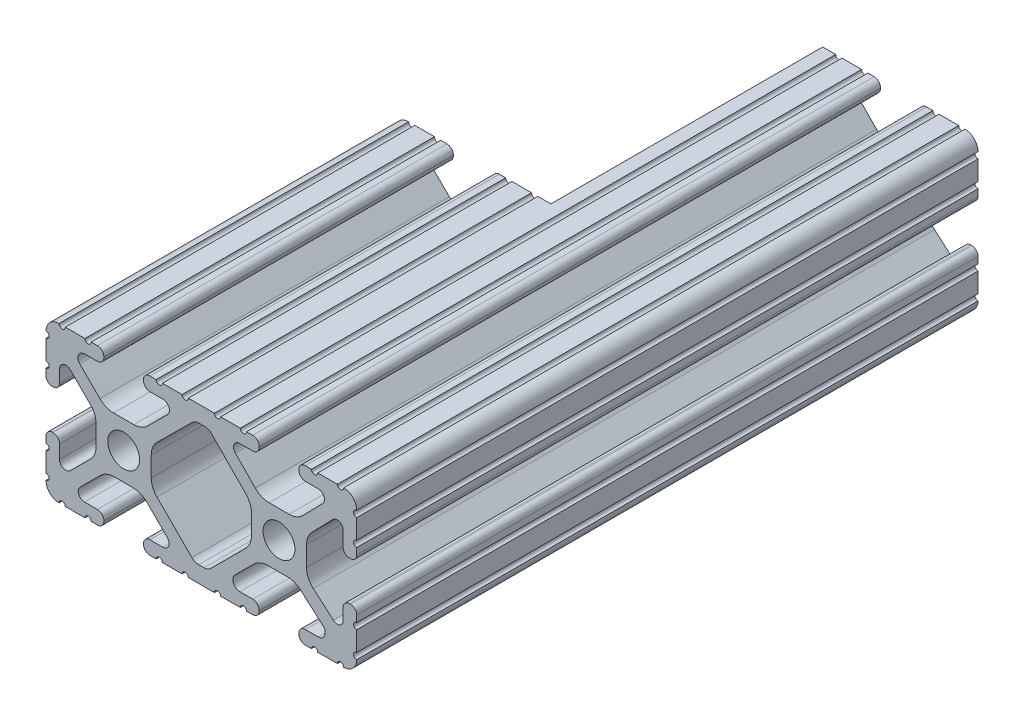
SolidWorks part; units mm, degrees
ref_plane "Front" through (0, 0, 0) normal (0, 0, 1) x (1, 0, 0)
ref_plane "Top" through (0, 0, 0) normal (0, 1, 0) x (1, 0, 0)
ref_plane "Right" through (0, 0, 0) normal (1, 0, 0) x (0, 0, -1)
sketch "Sketch1" plane through (0, 0, 0) normal (0, 0, 1) x (1, 0, 0)
  line L0 (-20.1324, -9.4742) -> (-5.2676, -9.4742) construction
  line L16 (-7.2595, -3.8694) -> (-1.5457, -9.5728)
  line L17 (-8.1915, 1.6223) -> (-8.1915, -1.6223)
  line L18 (-1.504, 9.5765) -> (-7.252, 3.8768)
  line L19 (0.5515, 10.033) -> (-0.3952, 10.033)
  line L20 (7.2829, 3.8459) -> (1.6756, 9.5611)
  line L21 (8.1915, -1.6223) -> (8.1915, 1.6223)
  line L22 (1.5457, -9.5728) -> (7.2595, -3.8694)
  line L23 (-0.4332, -10.033) -> (0.4332, -10.033)
  line L136 (18.0171, 12.7) -> (16.9875, 12.7)
  line L137 (15.9385, 11.651) -> (15.9385, 11.5392)
  line L138 (16.9875, 10.4902) -> (19.1164, 10.4902)
  line L139 (19.8441, 8.7652) -> (16.619, 5.4551)
  line L140 (14.3449, 4.4958) -> (11.0833, 4.4958)
  line L141 (8.817, 5.4472) -> (5.5642, 8.7627)
  line L142 (6.2894, 10.4902) -> (8.4125, 10.4902)
  line L143 (9.4615, 11.5392) -> (9.4615, 11.651)
  line L144 (8.4125, 12.7) -> (7.3829, 12.7)
  line L145 (6.3669, 12.7) -> (3.1496, 12.7)
  line L146 (2.1336, 12.7) -> (-2.1336, 12.7)
  line L147 (-3.1496, 12.7) -> (-6.3669, 12.7)
  line L148 (-7.3829, 12.7) -> (-8.4125, 12.7)
  line L149 (-9.4615, 11.651) -> (-9.4615, 11.5392)
  line L150 (-8.4125, 10.4902) -> (-6.2836, 10.4902)
  line L151 (-5.5326, 8.6661) -> (-8.81, 5.4163)
  line L152 (-11.0455, 4.4958) -> (-14.3545, 4.4958)
  line L153 (-16.59, 5.4163) -> (-19.8674, 8.6661)
  line L154 (-19.1164, 10.4902) -> (-16.9875, 10.4902)
  line L155 (-15.9385, 11.5392) -> (-15.9385, 11.651)
  line L156 (-16.9875, 12.7) -> (-18.0171, 12.7)
  line L157 (-19.0331, 12.7) -> (-22.2504, 12.7)
  line L158 (-25.4, 9.5504) -> (-25.4, 6.3331)
  line L159 (-25.4, 5.3171) -> (-25.4, 4.2375)
  line L160 (-24.401, 3.2385) -> (-24.2392, 3.2385)
  line L161 (-23.1902, 4.2875) -> (-23.1902, 6.3347)
  line L162 (-21.434, 7.0665) -> (-18.148, 3.8082)
  line L163 (-17.2085, 1.5536) -> (-17.2085, -1.6952)
  line L164 (-18.1405, -3.9423) -> (-21.4316, -7.2274)
  line L165 (-23.1902, -6.498) -> (-23.1902, -4.2875)
  line L166 (-24.2392, -3.2385) -> (-24.351, -3.2385)
  line L167 (-25.4, -4.2875) -> (-25.4, -5.3171)
  line L168 (-25.4, -6.3331) -> (-25.4, -9.5504)
  line L169 (-22.2504, -12.7) -> (-19.0331, -12.7)
  line L170 (-18.0171, -12.7) -> (-16.9875, -12.7)
  line L171 (-15.9384, -11.651) -> (-15.9384, -11.5392)
  line L172 (-16.9875, -10.4902) -> (-19.1164, -10.4902)
  line L173 (-19.8341, -8.7551) -> (-16.4966, -5.4237)
  line L174 (-14.2536, -4.4958) -> (-11.1464, -4.4958)
  line L175 (-8.9034, -5.4237) -> (-5.5659, -8.7551)
  line L176 (-6.2836, -10.4902) -> (-8.4125, -10.4902)
  line L177 (-9.4616, -11.5392) -> (-9.4616, -11.651)
  line L178 (-8.4125, -12.7) -> (-7.3829, -12.7)
  line L179 (-6.3669, -12.7) -> (-3.1496, -12.7)
  line L180 (-2.1336, -12.7) -> (2.1336, -12.7)
  line L181 (3.1496, -12.7) -> (6.3669, -12.7)
  line L182 (7.3829, -12.7) -> (8.4125, -12.7)
  line L183 (9.4616, -11.651) -> (9.4616, -11.5392)
  line L184 (8.4125, -10.4902) -> (6.2894, -10.4902)
  line L185 (5.4807, -8.5353) -> (8.5979, -5.4237)
  line L186 (10.8409, -4.4958) -> (14.1026, -4.4958)
  line L187 (16.1879, -5.2766) -> (19.8682, -8.4822)
  line L188 (19.1164, -10.4902) -> (16.9875, -10.4902)
  line L189 (15.9384, -11.5392) -> (15.9384, -11.651)
  line L190 (16.9875, -12.7) -> (18.0171, -12.7)
  line L191 (19.0331, -12.7) -> (22.2504, -12.7)
  line L192 (25.4, -9.5504) -> (25.4, -6.3331)
  line L193 (25.4, -5.3171) -> (25.4, -4.2375)
  line L194 (24.401, -3.2385) -> (24.1892, -3.2385)
  line L195 (23.1902, -4.2375) -> (23.1902, -6.1559)
  line L196 (21.584, -6.8869) -> (18.2982, -4.025)
  line L197 (17.2085, -1.6308) -> (17.2085, 1.6308)
  line L198 (18.1094, 3.8465) -> (21.5263, 7.3534)
  line L199 (23.1902, 6.6769) -> (23.1902, 4.2375)
  line L200 (24.1892, 3.2385) -> (24.401, 3.2385)
  line L201 (25.4, 4.2375) -> (25.4, 5.3171)
  line L202 (25.4, 6.3332) -> (25.4, 9.5504)
  line L203 (22.2504, 12.7) -> (19.0331, 12.7)
  circle A2 centre (-12.7, 0) radius 2.6035
  circle A4 centre (12.7, 0) radius 2.6035
  arc A18 (-1.5457, -9.5728) -> (-0.4332, -10.033) centre (-0.4332, -8.4582) ccw
  arc A19 (-8.1915, -1.6223) -> (-7.2595, -3.8694) centre (-5.0165, -1.6223) ccw
  arc A20 (-7.252, 3.8768) -> (-8.1915, 1.6223) centre (-5.0165, 1.6223) ccw
  arc A21 (-0.3952, 10.033) -> (-1.504, 9.5765) centre (-0.3952, 8.4582) ccw
  arc A22 (1.6756, 9.5611) -> (0.5515, 10.033) centre (0.5515, 8.4582) ccw
  arc A23 (8.1915, 1.6223) -> (7.2829, 3.8459) centre (5.0165, 1.6223) ccw
  arc A24 (7.2595, -3.8694) -> (8.1915, -1.6223) centre (5.0165, -1.6223) ccw
  arc A25 (0.4332, -10.033) -> (1.5457, -9.5728) centre (0.4332, -8.4582) ccw
  arc A152 (18.0171, 12.7) -> (19.0331, 12.7) centre (18.5251, 12.7) ccw
  arc A153 (16.9875, 12.7) -> (15.9385, 11.651) centre (16.9875, 11.651) ccw
  arc A154 (15.9385, 11.5392) -> (16.9875, 10.4902) centre (16.9875, 11.5392) ccw
  arc A155 (19.8441, 8.7652) -> (19.1164, 10.4902) centre (19.1164, 9.4742) ccw
  arc A156 (14.3449, 4.4958) -> (16.619, 5.4551) centre (14.3449, 7.6708) ccw
  arc A157 (8.817, 5.4472) -> (11.0833, 4.4958) centre (11.0833, 7.6708) ccw
  arc A158 (6.2894, 10.4902) -> (5.5642, 8.7627) centre (6.2894, 9.4742) ccw
  arc A159 (8.4125, 10.4902) -> (9.4615, 11.5392) centre (8.4125, 11.5392) ccw
  arc A160 (9.4615, 11.651) -> (8.4125, 12.7) centre (8.4125, 11.651) ccw
  arc A161 (6.3669, 12.7) -> (7.3829, 12.7) centre (6.8749, 12.7) ccw
  arc A162 (2.1336, 12.7) -> (3.1496, 12.7) centre (2.6416, 12.7) ccw
  arc A163 (-3.1496, 12.7) -> (-2.1336, 12.7) centre (-2.6416, 12.7) ccw
  arc A164 (-7.3829, 12.7) -> (-6.3669, 12.7) centre (-6.8749, 12.7) ccw
  arc A165 (-8.4125, 12.7) -> (-9.4615, 11.651) centre (-8.4125, 11.651) ccw
  arc A166 (-9.4615, 11.5392) -> (-8.4125, 10.4902) centre (-8.4125, 11.5392) ccw
  arc A167 (-5.5326, 8.6661) -> (-6.2836, 10.4902) centre (-6.2836, 9.4235) ccw
  arc A168 (-11.0455, 4.4958) -> (-8.81, 5.4163) centre (-11.0455, 7.6708) ccw
  arc A169 (-16.59, 5.4163) -> (-14.3545, 4.4958) centre (-14.3545, 7.6708) ccw
  arc A170 (-19.1164, 10.4902) -> (-19.8674, 8.6661) centre (-19.1164, 9.4235) ccw
  arc A171 (-16.9875, 10.4902) -> (-15.9385, 11.5392) centre (-16.9875, 11.5392) ccw
  arc A172 (-15.9385, 11.651) -> (-16.9875, 12.7) centre (-16.9875, 11.651) ccw
  arc A173 (-19.0331, 12.7) -> (-18.0171, 12.7) centre (-18.5251, 12.7) ccw
  arc A174 (-23.2664, 12.6998) -> (-22.2504, 12.7) centre (-22.7584, 12.7) ccw
  arc A175 (-23.2664, 12.6998) -> (-25.3998, 10.5664) centre (-23.2918, 10.5918) ccw
  arc A176 (-25.4, 9.5504) -> (-25.3998, 10.5664) centre (-25.4, 10.0584) ccw
  arc A177 (-25.4, 5.3171) -> (-25.4, 6.3331) centre (-25.4, 5.8251) ccw
  arc A178 (-25.4, 4.2375) -> (-24.401, 3.2385) centre (-24.401, 4.2375) ccw
  arc A179 (-24.2392, 3.2385) -> (-23.1902, 4.2875) centre (-24.2392, 4.2875) ccw
  arc A180 (-21.434, 7.0665) -> (-23.1902, 6.3347) centre (-22.1596, 6.3347) ccw
  arc A181 (-17.2085, 1.5536) -> (-18.148, 3.8082) centre (-20.3835, 1.5536) ccw
  arc A182 (-18.1405, -3.9423) -> (-17.2085, -1.6952) centre (-20.3835, -1.6952) ccw
  arc A183 (-23.1902, -6.498) -> (-21.4316, -7.2274) centre (-22.1596, -6.498) ccw
  arc A184 (-23.1902, -4.2875) -> (-24.2392, -3.2385) centre (-24.2392, -4.2875) ccw
  arc A185 (-24.351, -3.2385) -> (-25.4, -4.2875) centre (-24.351, -4.2875) ccw
  arc A186 (-25.4, -6.3331) -> (-25.4, -5.3171) centre (-25.4, -5.8251) ccw
  arc A187 (-25.3998, -10.5664) -> (-25.4, -9.5504) centre (-25.4, -10.0584) ccw
  arc A188 (-25.3998, -10.5664) -> (-23.2664, -12.6998) centre (-23.2918, -10.5918) ccw
  arc A189 (-22.2504, -12.7) -> (-23.2664, -12.6998) centre (-22.7584, -12.7) ccw
  arc A190 (-18.0171, -12.7) -> (-19.0331, -12.7) centre (-18.5251, -12.7) ccw
  arc A191 (-16.9875, -12.7) -> (-15.9384, -11.651) centre (-16.9875, -11.651) ccw
  arc A192 (-15.9384, -11.5392) -> (-16.9875, -10.4902) centre (-16.9875, -11.5392) ccw
  arc A193 (-19.8341, -8.7551) -> (-19.1164, -10.4902) centre (-19.1164, -9.4742) ccw
  arc A194 (-14.2536, -4.4958) -> (-16.4966, -5.4237) centre (-14.2536, -7.6708) ccw
  arc A195 (-8.9034, -5.4237) -> (-11.1464, -4.4958) centre (-11.1464, -7.6708) ccw
  arc A196 (-6.2836, -10.4902) -> (-5.5659, -8.7551) centre (-6.2836, -9.4742) ccw
  arc A197 (-8.4125, -10.4902) -> (-9.4616, -11.5392) centre (-8.4125, -11.5392) ccw
  arc A198 (-9.4616, -11.651) -> (-8.4125, -12.7) centre (-8.4125, -11.651) ccw
  arc A199 (-6.3669, -12.7) -> (-7.3829, -12.7) centre (-6.8749, -12.7) ccw
  arc A200 (-2.1336, -12.7) -> (-3.1496, -12.7) centre (-2.6416, -12.7) ccw
  arc A201 (3.1496, -12.7) -> (2.1336, -12.7) centre (2.6416, -12.7) ccw
  arc A202 (7.3829, -12.7) -> (6.3669, -12.7) centre (6.8749, -12.7) ccw
  arc A203 (8.4125, -12.7) -> (9.4616, -11.651) centre (8.4125, -11.651) ccw
  arc A204 (9.4616, -11.5392) -> (8.4125, -10.4902) centre (8.4125, -11.5392) ccw
  arc A205 (5.4807, -8.5353) -> (6.2894, -10.4902) centre (6.2894, -9.3455) ccw
  arc A206 (10.8409, -4.4958) -> (8.5979, -5.4237) centre (10.8409, -7.6708) ccw
  arc A207 (16.1879, -5.2766) -> (14.1026, -4.4958) centre (14.1026, -7.6708) ccw
  arc A208 (19.1164, -10.4902) -> (19.8682, -8.4822) centre (19.1164, -9.3455) ccw
  arc A209 (16.9875, -10.4902) -> (15.9384, -11.5392) centre (16.9875, -11.5392) ccw
  arc A210 (15.9384, -11.651) -> (16.9875, -12.7) centre (16.9875, -11.651) ccw
  arc A211 (19.0331, -12.7) -> (18.0171, -12.7) centre (18.5251, -12.7) ccw
  arc A212 (23.2664, -12.6998) -> (22.2504, -12.7) centre (22.7584, -12.7) ccw
  arc A213 (23.2664, -12.6998) -> (25.3998, -10.5664) centre (23.2918, -10.5918) ccw
  arc A214 (25.4, -9.5504) -> (25.3998, -10.5664) centre (25.4, -10.0584) ccw
  arc A215 (25.4, -5.3171) -> (25.4, -6.3331) centre (25.4, -5.8251) ccw
  arc A216 (25.4, -4.2375) -> (24.401, -3.2385) centre (24.401, -4.2375) ccw
  arc A217 (24.1892, -3.2385) -> (23.1902, -4.2375) centre (24.1892, -4.2375) ccw
  arc A218 (21.584, -6.8869) -> (23.1902, -6.1559) centre (22.2207, -6.1559) ccw
  arc A219 (17.2085, -1.6308) -> (18.2982, -4.025) centre (20.3835, -1.6308) ccw
  arc A220 (18.1094, 3.8465) -> (17.2085, 1.6308) centre (20.3835, 1.6308) ccw
  arc A221 (23.1902, 6.6769) -> (21.5263, 7.3534) centre (22.2207, 6.6769) ccw
  arc A222 (23.1902, 4.2375) -> (24.1892, 3.2385) centre (24.1892, 4.2375) ccw
  arc A223 (24.401, 3.2385) -> (25.4, 4.2375) centre (24.401, 4.2375) ccw
  arc A224 (25.4, 6.3332) -> (25.4, 5.3171) centre (25.4, 5.8251) ccw
  arc A225 (25.3998, 10.5664) -> (25.4, 9.5504) centre (25.4, 10.0584) ccw
  arc A226 (25.3998, 10.5664) -> (23.2664, 12.6998) centre (23.2918, 10.5918) ccw
  arc A227 (22.2504, 12.7) -> (23.2664, 12.6998) centre (22.7584, 12.7) ccw
extrude "Boss-Extrude1" add sketch "Sketch1" along normal mid plane 101.6
sketch "Sketch2" plane through (0, 12.7, 0) normal (0, 1, 0) x (1, 0, 0)
  line L1 (-25.4, 50.8) -> (0, 50.8)
  line L2 (-25.4, 50.8) -> (-25.4, 6.35)
  line L3 (-25.4, 6.35) -> (0, 6.35)
  line L4 (0, 50.8) -> (0, 6.35)
  line L5 (-25.4, -50.8) -> (-25.4, 50.8) construction
  line L6 (19.0331, 50.8) -> (18.0171, 50.8) construction
  line L9 (-19.0331, -50.8) -> (-22.2504, -50.8) construction
  dimension "D1" = 57.15
  dimension "D2" = 25.4
extrude "Cut-Extrude1" cut sketch "Sketch2" against normal through all
